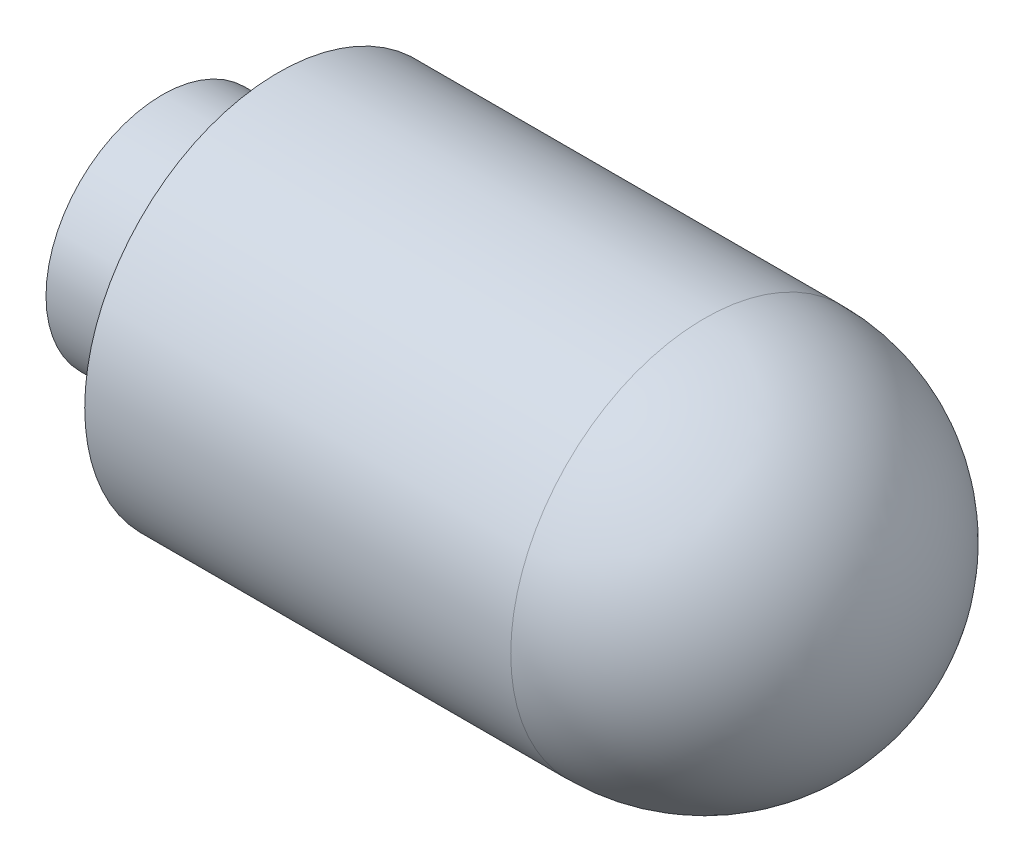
SolidWorks part; units mm, degrees
ref_plane "Plan de face" through (0, 0, 0) normal (0, 0, 1) x (1, 0, 0)
ref_plane "Plan de dessus" through (0, 0, 0) normal (0, 1, 0) x (1, 0, 0)
ref_plane "Plan de droite" through (0, 0, 0) normal (1, 0, 0) x (0, 0, -1)
sketch "Esquisse1" plane through (0, 0, 0) normal (0, 0, 1) x (1, 0, 0)
  line L0 (0, 0) -> (0, 1.5)
  line L1 (0, 1.5) -> (1.5, 1.5)
  line L2 (1.5, 1.5) -> (1.5, 2.5)
  line L3 (1.5, 2.5) -> (9.5, 2.5)
  line L4 (9.5, 2.5) -> (9.5, 0)
  line L5 (0, 0) -> (9.5, 0)
  line L6 (-4.2142, 0) -> (15.4272, 0) construction
  dimension "D1" = 2.5
  dimension "D2" = 1.5
  dimension "D3" = 1.5
  dimension "D4" = 8
revolve "Révolution1" add sketch "Esquisse1" angle 360 about L6
fillet "Congé1" radius 2.5 1 edges at (9.5, 0, 2.5)
